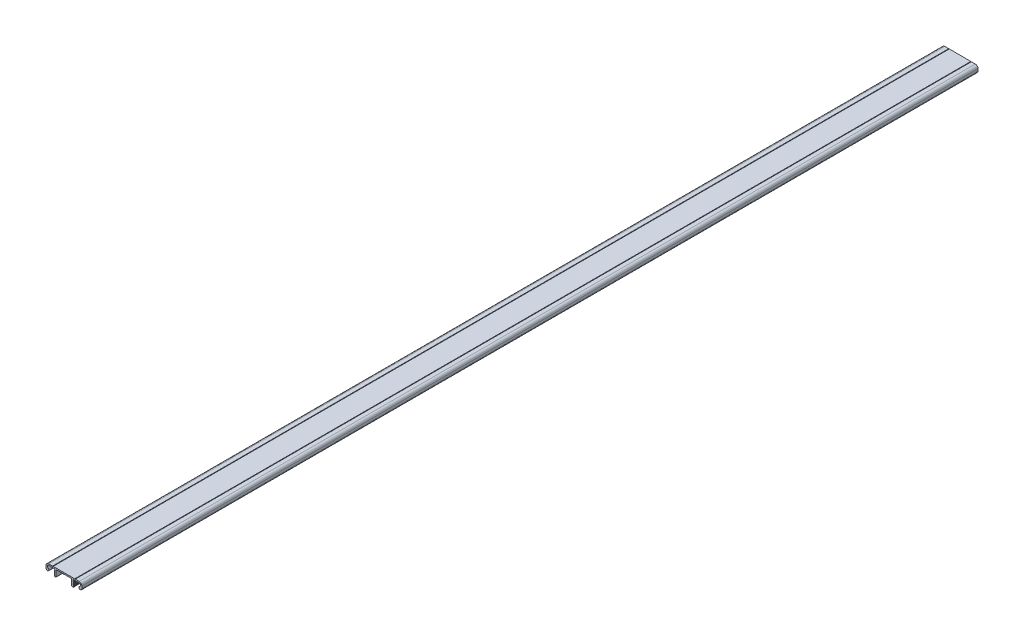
SolidWorks part; units mm, degrees
ref_plane "Ebene vorne" through (0, 0, 0) normal (0, 0, 1) x (1, 0, 0)
ref_plane "Ebene oben" through (0, 0, 0) normal (0, 1, 0) x (1, 0, 0)
ref_plane "Ebene rechts" through (0, 0, 0) normal (1, 0, 0) x (0, 0, -1)
sketch "Model" plane through (0, 0, 0) normal (0, 0, 1) x (1, 0, 0)
  line L280 (-31.2879, 63.5592) -> (-55.3879, 63.5592)
  line L281 (-55.9879, 63.5592) -> (-55.6879, 63.2592)
  line L282 (-55.6879, 63.2592) -> (-55.3879, 63.5592)
  line L283 (-52.0379, 55.0592) -> (-52.0379, 61.5592)
  line L284 (-51.5379, 62.0592) -> (-43.6843, 62.0592)
  line L285 (-42.9915, 62.0592) -> (-35.1379, 62.0592)
  line L286 (-54.0879, 55.0592) -> (-54.0879, 55.3916)
  line L287 (-54.0879, 55.3916) -> (-53.5379, 55.7092)
  line L288 (-53.5379, 55.7092) -> (-54.0879, 56.0267)
  line L289 (-54.0879, 56.0267) -> (-54.0879, 56.7917)
  line L290 (-54.0879, 56.7917) -> (-53.5379, 57.1092)
  line L291 (-53.5379, 57.1092) -> (-54.0879, 57.4267)
  line L292 (-54.0879, 57.4267) -> (-54.0879, 58.1916)
  line L293 (-54.0879, 58.1916) -> (-53.5379, 58.5092)
  line L294 (-53.5379, 58.5092) -> (-54.0879, 58.8267)
  line L295 (-54.0879, 58.8267) -> (-54.0879, 59.5916)
  line L296 (-54.0879, 59.5916) -> (-53.5379, 59.9092)
  line L297 (-53.5379, 59.9092) -> (-54.0879, 60.2267)
  line L298 (-54.0879, 60.2267) -> (-54.0879, 60.9916)
  line L299 (-54.0879, 60.9916) -> (-53.5379, 61.3092)
  line L300 (-53.5379, 61.3092) -> (-53.5379, 61.5592)
  line L301 (-53.5879, 54.5592) -> (-52.5379, 54.5592)
  line L302 (-30.6879, 63.5592) -> (-30.9879, 63.2592)
  line L303 (-30.9879, 63.2592) -> (-31.2879, 63.5592)
  line L304 (-34.6379, 55.0592) -> (-34.6379, 61.5592)
  line L305 (-32.5879, 55.0592) -> (-32.5879, 55.3916)
  line L306 (-32.5879, 55.3916) -> (-33.1379, 55.7092)
  line L307 (-33.1379, 55.7092) -> (-32.5879, 56.0267)
  line L308 (-32.5879, 56.0267) -> (-32.5879, 56.7916)
  line L309 (-32.5879, 56.7916) -> (-33.1379, 57.1092)
  line L310 (-33.1379, 57.1092) -> (-32.5879, 57.4267)
  line L311 (-32.5879, 57.4267) -> (-32.5879, 58.1916)
  line L312 (-32.5879, 58.1916) -> (-33.1379, 58.5092)
  line L313 (-33.1379, 58.5092) -> (-32.5879, 58.8267)
  line L314 (-32.5879, 58.8267) -> (-32.5879, 59.5916)
  line L315 (-32.5879, 59.5916) -> (-33.1379, 59.9092)
  line L316 (-33.1379, 59.9092) -> (-32.5879, 60.2267)
  line L317 (-32.5879, 60.2267) -> (-32.5879, 60.9916)
  line L318 (-33.1313, 61.3053) -> (-33.1313, 61.5592)
  line L319 (-33.0879, 54.5592) -> (-34.1379, 54.5592)
  line L320 (-33.1313, 61.3053) -> (-32.5879, 60.9916)
  line L321 (-60.3379, 63.5592) -> (-55.9879, 63.5592)
  line L322 (-60.3379, 62.0592) -> (-54.0379, 62.0592)
  line L323 (-63.3379, 60.5592) -> (-63.3379, 58.2349)
  line L324 (-26.3379, 63.5592) -> (-30.6879, 63.5592)
  line L325 (-26.3379, 62.0592) -> (-32.6313, 62.0592)
  line L326 (-23.539, 57.221) -> (-23.406, 57.7172)
  line L327 (-23.3379, 58.2348) -> (-23.3379, 60.5592)
  line L328 (-63.2698, 57.7172) -> (-63.1368, 57.221)
  line L329 (-26.0843, 58.6329) -> (-25.2415, 59.5355)
  line L330 (-60.5915, 58.6329) -> (-61.4343, 59.5355)
  arc A74 (-51.5379, 62.0592) -> (-52.0379, 61.5592) centre (-51.5379, 61.5592) ccw
  arc A75 (-54.0879, 55.0592) -> (-53.5879, 54.5592) centre (-53.5879, 55.0592) ccw
  arc A76 (-53.5379, 61.5592) -> (-54.0379, 62.0592) centre (-54.0379, 61.5592) ccw
  arc A77 (-52.5379, 54.5592) -> (-52.0379, 55.0592) centre (-52.5379, 55.0592) ccw
  arc A78 (-34.6379, 61.5592) -> (-35.1379, 62.0592) centre (-35.1379, 61.5592) ccw
  arc A79 (-33.0879, 54.5592) -> (-32.5879, 55.0592) centre (-33.0879, 55.0592) ccw
  arc A80 (-32.6313, 62.0592) -> (-33.1313, 61.5592) centre (-32.6313, 61.5592) ccw
  arc A81 (-34.6379, 55.0592) -> (-34.1379, 54.5592) centre (-34.1379, 55.0592) ccw
  arc A82 (-60.3379, 63.5592) -> (-63.3379, 60.5592) centre (-60.3379, 60.5592) ccw
  arc A83 (-63.3379, 58.2349) -> (-63.2698, 57.7172) centre (-61.3379, 58.2349) ccw
  arc A84 (-23.406, 57.7172) -> (-23.3379, 58.2348) centre (-25.3379, 58.2348) ccw
  arc A85 (-23.3379, 60.5592) -> (-26.3379, 63.5592) centre (-26.3379, 60.5592) ccw
  arc A86 (-26.0843, 58.6329) -> (-23.539, 57.221) centre (-24.9879, 57.6092) ccw
  arc A87 (-25.2415, 59.5355) -> (-26.3379, 62.0592) centre (-26.3379, 60.5592) ccw
  arc A88 (-63.1368, 57.221) -> (-60.5915, 58.6329) centre (-61.6879, 57.6092) ccw
  arc A89 (-60.3379, 62.0592) -> (-61.4343, 59.5355) centre (-60.3379, 60.5592) ccw
  arc A90 (-43.6843, 62.0592) -> (-42.9915, 62.0592) centre (-43.3379, 62.1092) ccw
extrude "Aufsatz-Linear austragen1" add sketch "Model" along normal blind 1000
